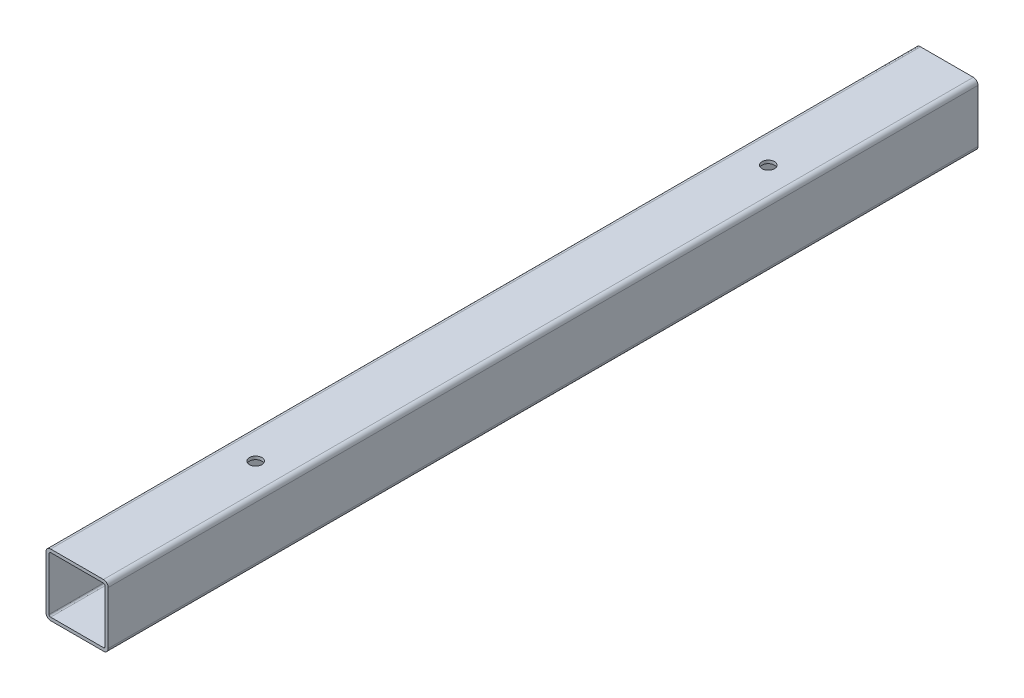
SolidWorks part; units mm, degrees
ref_plane "Plan1" through (0, 0, 0) normal (0, 0, 1) x (1, 0, 0)
ref_plane "Plan2" through (0, 0, 0) normal (0, 1, 0) x (1, 0, 0)
ref_plane "Plan3" through (0, 0, 0) normal (1, 0, 0) x (0, 0, -1)
sketch "Esquisse1" plane through (0, 0, 0) normal (0, 0, 1) x (1, 0, 0)
  line L0 (3, 2) -> (37, 2)
  line L1 (3, 0) -> (37, 0)
  line L2 (0, 3) -> (0, 37)
  line L3 (3, 40) -> (37, 40)
  line L4 (40, 3) -> (40, 37)
  line L5 (38, 3) -> (38, 37)
  line L6 (3, 38) -> (37, 38)
  line L7 (2, 3) -> (2, 37)
  arc A0 (3, 38) -> (2, 37) centre (3, 37) ccw
  arc A1 (38, 37) -> (37, 38) centre (37, 37) ccw
  arc A2 (37, 2) -> (38, 3) centre (37, 3) ccw
  arc A3 (2, 3) -> (3, 2) centre (3, 3) ccw
  arc A4 (3, 40) -> (0, 37) centre (3, 37) ccw
  arc A5 (40, 37) -> (37, 40) centre (37, 37) ccw
  arc A6 (37, 0) -> (40, 3) centre (37, 3) ccw
  arc A7 (0, 3) -> (3, 0) centre (3, 3) ccw
  point P19 (0, 40)
  point P22 (40, 40)
  point P27 (0, 0)
  dimension "D4" = 1
  dimension "D5" = 3
  dimension "D1" = 40
  dimension "D2" = 40
  dimension "D3" = 2
extrude "Extrusion1" add sketch "Esquisse1" along normal blind 560
sketch "Esquisse2" plane through (0, 40, 0) normal (0, 1, 0) x (-1, 0, 0)
  line L0 (-37, 560) -> (-3, 560) construction
  line L1 (-40, 560) -> (-40, 0) construction
  line L2 (-37, 0) -> (-3, 0) construction
  circle A0 centre (-20, 115) radius 4
  circle A1 centre (-20, 445) radius 4
  dimension "D1" = 8
  dimension "D2" = 8
  dimension "D3" = 115
  dimension "D4" = 20
  dimension "D5" = 20
  dimension "D6" = 115
extrude "Enlèv. mat.-Extru.1" cut sketch "Esquisse2" against normal through all
